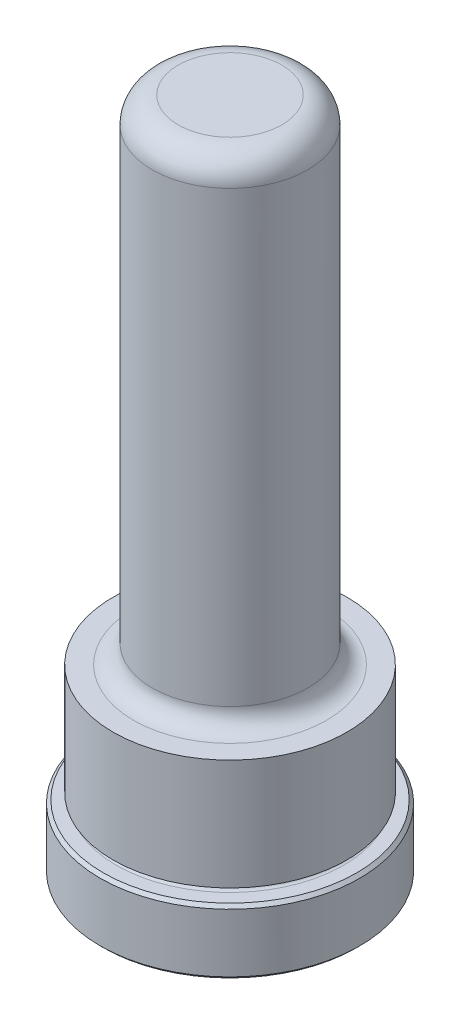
SolidWorks part; units mm, degrees
ref_plane "Front Plane" through (0, 0, 0) normal (0, 0, 1) x (1, 0, 0)
ref_plane "Top Plane" through (0, 0, 0) normal (0, 1, 0) x (1, 0, 0)
ref_plane "Right Plane" through (0, 0, 0) normal (1, 0, 0) x (0, 0, -1)
sketch "Sketch1" plane through (0, 0, 0) normal (1, 0, 0) x (0, 0, -1)
  line L0 (0, 0) -> (15.875, 0)
  line L1 (15.875, 0) -> (15.875, 7.9248)
  line L2 (15.875, 7.9248) -> (13.8938, 7.9248)
  line L3 (13.5128, 2.6782) -> (13.5128, 5.9795) construction
  line L4 (13.8938, 8.6868) -> (14.3002, 8.6868)
  line L5 (14.3002, 8.6868) -> (14.3002, 22.225)
  line L6 (14.3002, 22.225) -> (11.7983, 22.225)
  line L7 (9.5123, 24.511) -> (9.5123, 82.55)
  line L9 (9.5123, 82.55) -> (0, 82.55)
  line L10 (0, 82.55) -> (0, 0)
  line L11 (0, 0) -> (0, -7.2694) construction
  arc A0 (13.8938, 8.6868) -> (13.8938, 7.9248) centre (13.8938, 8.3058) ccw
  arc A1 (11.7983, 22.225) -> (9.5123, 24.511) centre (11.7983, 24.511) cw
  point P2 (9.5123, 82.55)
  point P14 (9.5123, 82.4235)
  point P19 (9.5123, 22.225)
  dimension "D14" = 0.762
  dimension "D8" = 2.286
  dimension "T" = 7.9248
  dimension "D2" = 0.762
  dimension "M" = 31.75
  dimension "B" = 28.6004
  dimension "L" = 82.55
  dimension "D7" = 0.7874
  dimension "A" = 22.225
  dimension "D" = 19.0246
  dimension "D15" = 60.325
revolve "Revolve1" add sketch "Sketch1" angle 360 about L11
chamfer "Chamfer1" distance 0.381 angle 45 2 edges at (0, 0, 15.875) (0, 7.9248, 15.875)
fillet "Fillet1" radius 3.175 1 edges at (0, 82.55, 9.5123)
